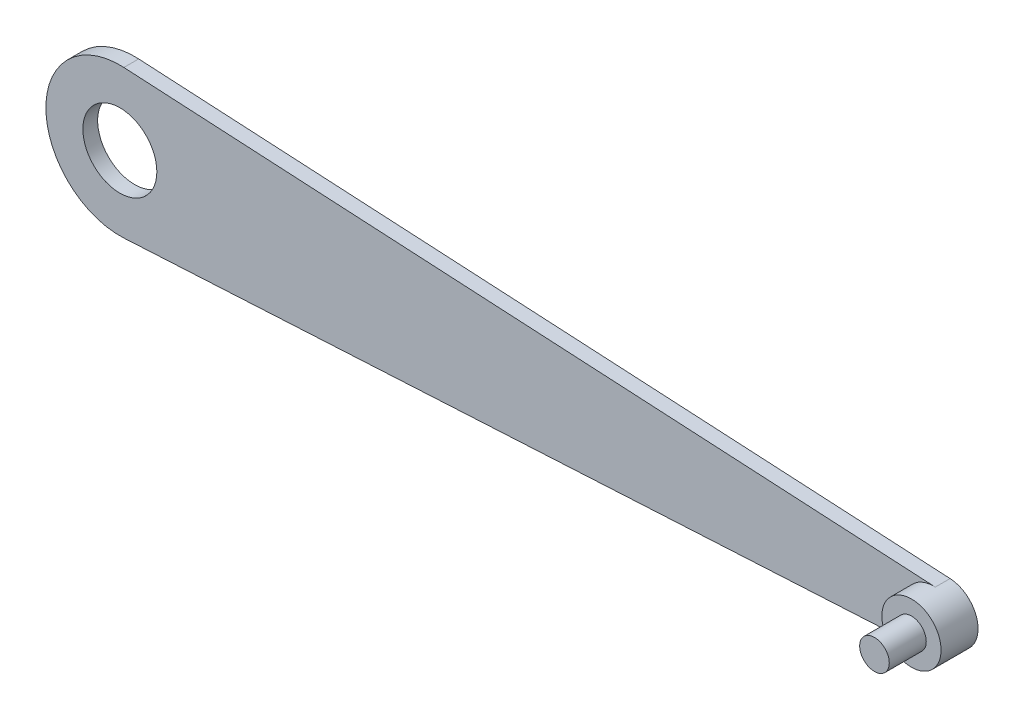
SolidWorks part; units mm, degrees
ref_plane "Front" through (0, 0, 0) normal (0, 0, 1) x (1, 0, 0)
ref_plane "Top" through (0, 0, 0) normal (0, 1, 0) x (1, 0, 0)
ref_plane "Right" through (0, 0, 0) normal (1, 0, 0) x (0, 0, -1)
sketch "Sketch1" plane through (0, 0, 0) normal (0, 0, 1) x (1, 0, 0)
  circle A0 centre (0, 0) radius 2.5
  circle A1 centre (0, 0) radius 5
extrude "Extrude1" add sketch "Sketch1" along normal blind 1
sketch "Sketch2" plane through (0, 0, 0) normal (0, 0, 1) x (1, 0, 0)
  line L0 (0, 0) -> (55, 0) construction
  circle A0 centre (55, 0) radius 2
  dimension "D1" = 55
extrude "Extrude2" add sketch "Sketch2" along normal blind 2.5
sketch "Sketch3" plane through (0, 0, 2.5) normal (0, 0, 1) x (1, 0, 0)
  circle A0 centre (55, 0) radius 1
  dimension "D1" = 2
extrude "Extrude3" add sketch "Sketch3" along normal blind 2.5
sketch "Sketch4" plane through (0, 0, 0) normal (0, 0, 1) x (1, 0, 0)
  line L0 (0.2727, 4.9926) -> (55.1091, 1.997)
  line L1 (0.2727, -4.9926) -> (55.1091, -1.997)
  arc A0 (0.2727, -4.9926) -> (0.2727, 4.9926) centre (0, 0) ccw
  arc A1 (55.1091, 1.997) -> (55.1091, -1.997) centre (55, 0) ccw
  dimension "D1" = 10
  dimension "D2" = 4
extrude "Extrude4" add sketch "Sketch4" along normal blind 1
